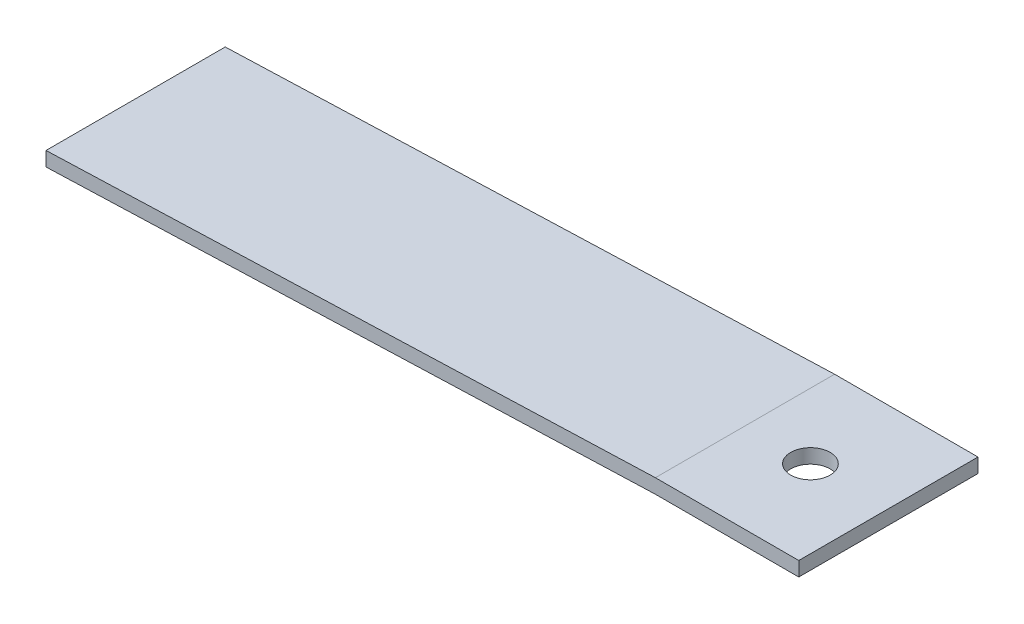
SolidWorks part; units mm, degrees
ref_plane "Front" through (0, 0, 0) normal (0, 0, 1) x (1, 0, 0)
ref_plane "Top" through (0, 0, 0) normal (0, 1, 0) x (1, 0, 0)
ref_plane "Right" through (0, 0, 0) normal (1, 0, 0) x (0, 0, -1)
sketch "Sketch1" plane through (0, 0, 0) normal (0, 0, 1) x (1, 0, 0)
  line L0 (0, 0) -> (-34, -1.1873)
  line L1 (0, 0) -> (8, 0)
  line L2 (0, 0) -> (0, 1.2783) construction
  line L3 (0, 0.8) -> (8, 0.8)
  line L4 (8, 0) -> (8, 0.8)
  line L5 (-34, -1.1873) -> (-34, -0.3873)
  line L6 (-34, -0.3873) -> (0, 0.8)
  dimension "D1" = 8
  dimension "D2" = 0.8
  dimension "D3" = 92
  dimension "D4" = 42
extrude "Boss-Extrude1" add sketch "Sketch1" along normal mid plane 10
sketch "Sketch2" plane through (0, 0.8, 0) normal (0, 1, 0) x (1, 0, 0)
  line L0 (8, -5) -> (8, 5) construction
  circle A0 centre (3.65, 0) radius 1.1
  dimension "D1" = 2.2
  dimension "D2" = 4.35
extrude "Cut-Extrude1" cut sketch "Sketch2" against normal blind 10
